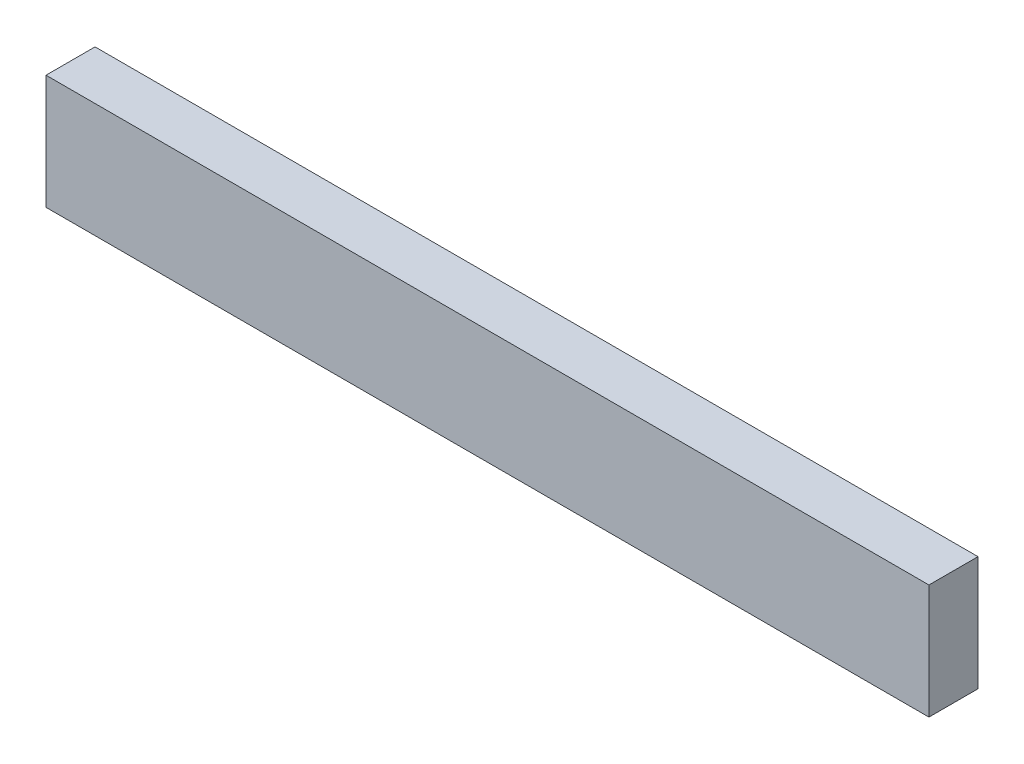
SolidWorks part; units mm, degrees
ref_plane "Front Plane" through (0, 0, 0) normal (0, 0, 1) x (1, 0, 0)
ref_plane "Top Plane" through (0, 0, 0) normal (0, 1, 0) x (1, 0, 0)
ref_plane "Right Plane" through (0, 0, 0) normal (1, 0, 0) x (0, 0, -1)
sketch "Sketch1" plane through (0, 0, 0) normal (1, 0, 0) x (0, 0, -1)
  line L1 (-19.05, -44.45) -> (19.05, -44.45)
  line L2 (-19.05, -44.45) -> (-19.05, 44.45)
  line L3 (-19.05, 44.45) -> (19.05, 44.45)
  line L4 (19.05, -44.45) -> (19.05, 44.45)
  line L5 (-19.05, -44.45) -> (19.05, 44.45) construction
  line L6 (-19.05, 44.45) -> (19.05, -44.45) construction
  point P0 (0, 0)
  dimension "D1" = 88.9
  dimension "D2" = 38.1
extrude "Boss-Extrude1" add sketch "Sketch1" along normal blind 685.8
